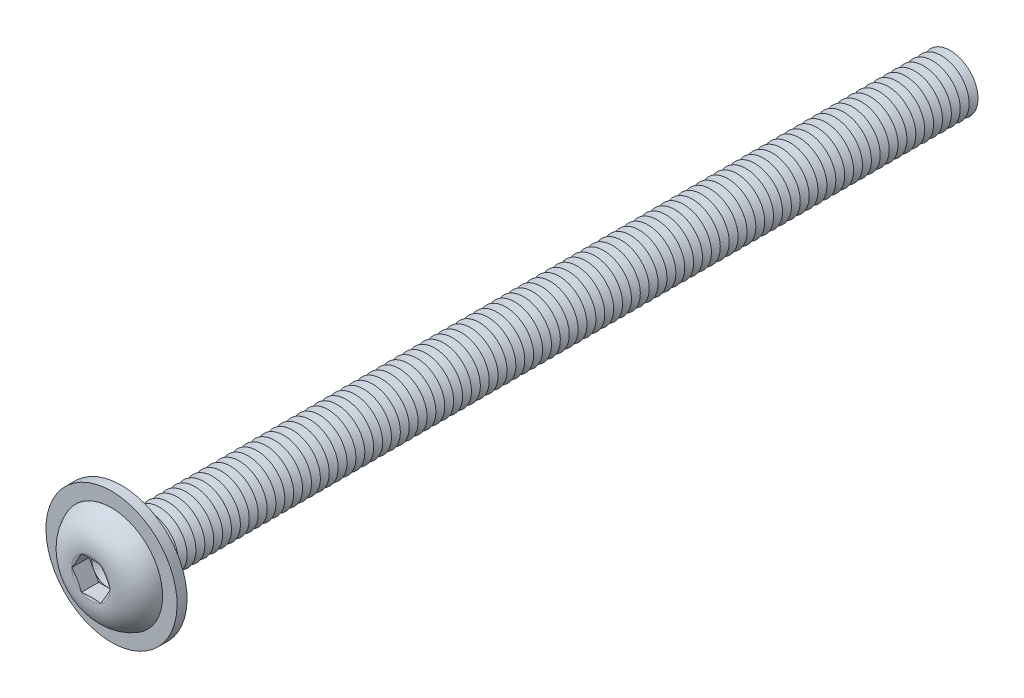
SolidWorks part; units mm, degrees
ref_plane "Front Plane" through (0, 0, 0) normal (0, 0, 1) x (1, 0, 0)
ref_plane "Top Plane" through (0, 0, 0) normal (0, 1, 0) x (1, 0, 0)
ref_plane "Right Plane" through (0, 0, 0) normal (1, 0, 0) x (0, 0, -1)
sketch "Sketch1" plane through (0, 0, 0) normal (1, 0, 0) x (0, 0, -1)
  line L0 (0, 2.5) -> (0, 4.75)
  line L3 (0, 2.5) -> (75, 2.5)
  line L4 (75, 2.5) -> (75, 0)
  line L5 (75, 0) -> (-2.75, 0) construction
  line L6 (-2.75, 0) -> (75, 0)
  line L7 (-2.75, 1.732) -> (-2.75, 0.866) construction
  line L8 (-2.75, 0.866) -> (-2.75, 0)
  line L9 (-2.75, 1.732) -> (-2.5179, 0.866)
  line L10 (-2.5179, 0.866) -> (-2.75, 0.866)
  line L11 (75, 0) -> (22.7481, 0) construction
  line L12 (0, 4.75) -> (-2.75, 4.75) construction
  arc A1 (0, 4.75) -> (-2.75, 1.732) centre (0, 1.9881) ccw
  point P8 (75, 1.25)
  dimension "D1" = 9.5
  dimension "D2" = 5
  dimension "D3" = 2.75
  dimension "D4" = 3.4641
  dimension "D5" = 75
  dimension "D6" = 15
revolve "Revolve1" add sketch "Sketch1" angle 360 about L5
fillet "Fillet1" radius 0.4 1 edges at (0, 2.5, 0)
sketch "Sketch2" plane through (0, 0, 0) normal (1, 0, 0) x (0, 0, -1)
  line L0 (74.6, 2.5) -> (75.4, 2.5)
  line L1 (75, 2.5) -> (0.4, 2.5) construction
  line L2 (75.4, 2.5) -> (75, 1.8072)
  line L3 (75, -2.5) -> (75, 2.5) construction
  line L4 (75, 1.8072) -> (74.6, 2.5)
  dimension "D1" = 0.8
revolve "Cut-Revolve1" cut sketch "Sketch2" angle 360 about axis through (0, 0, -75) along (0, 0, -1)
pattern_linear "LPattern1" count 93 spacing 0.8 along (0, 0, 1) of "Cut-Revolve1"
sketch "Sketch3" plane through (0, 0, 2.75) normal (0, 0, 1) x (1, 0, 0)
  line L7 (0.866, 1.5) -> (-0.866, 1.5)
  line L8 (-0.866, 1.5) -> (-1.7321, 0)
  line L9 (-1.7321, 0) -> (-0.866, -1.5)
  line L10 (-0.866, -1.5) -> (0.866, -1.5)
  line L11 (0.866, -1.5) -> (1.732, 0)
  line L12 (1.732, 0) -> (0.866, 1.5)
  circle A0 centre (0, 0) radius 1.5 construction
  circle A3 centre (0, 0) radius 1.7321 construction
extrude "Cut-Extrude1" cut sketch "Sketch3" against normal blind 1.56
sketch "Sketch4" plane through (0, 0, 1.19) normal (0, 0, 1) x (1, 0, 0)
  line L1 (0.866, 1.5) -> (-0.866, 1.5) construction
  circle A0 centre (0, 0) radius 1.5
extrude "Cut-Extrude2" cut sketch "Sketch4" against normal through all draft 60
sketch "Sketch5" plane through (0, 0, 0) normal (0, 0, -1) x (-1, 0, 0)
  circle A0 centre (0, 0) radius 5.9
  circle A1 centre (0, 0) radius 2.9
  circle A2 centre (0, 0) radius 2.9 construction
  dimension "D1" = 11.8
extrude "Boss-Extrude1" add sketch "Sketch5" against normal blind 0.9
